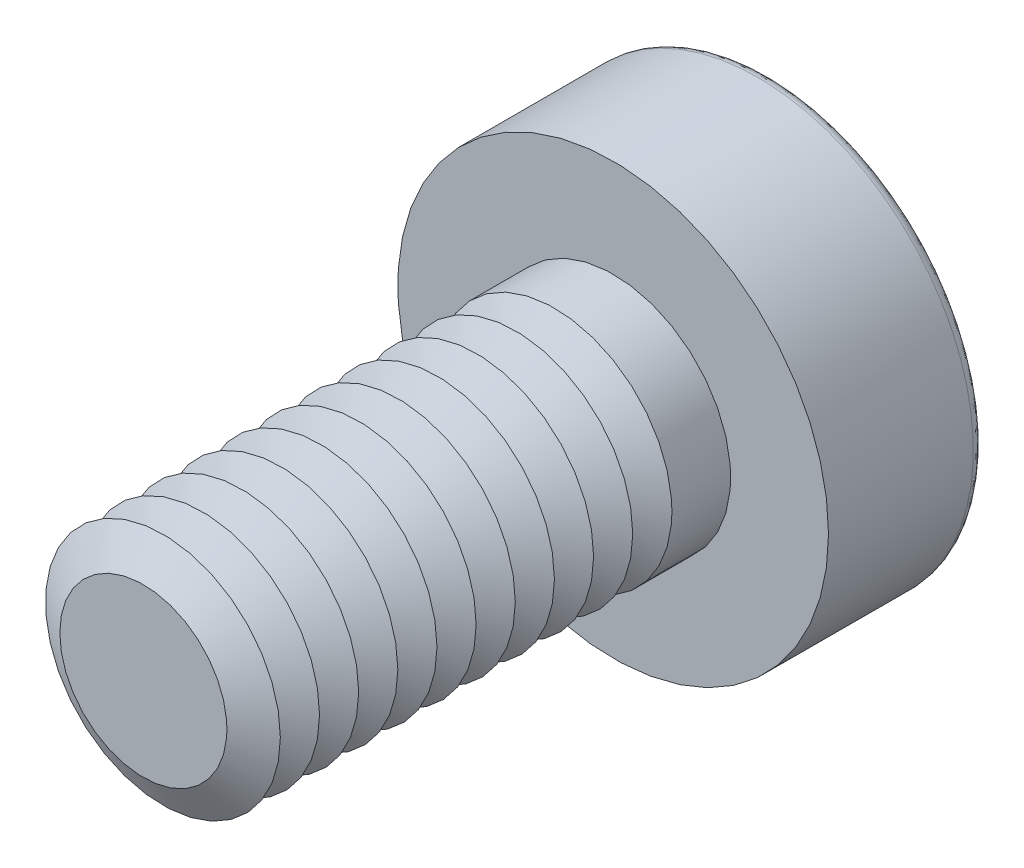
SolidWorks part; units mm, degrees
ref_plane "Front Plane" through (0, 0, 0) normal (0, 0, 1) x (1, 0, 0)
ref_plane "Top Plane" through (0, 0, 0) normal (0, 1, 0) x (1, 0, 0)
ref_plane "Right Plane" through (0, 0, 0) normal (1, 0, 0) x (0, 0, -1)
sketch "Sketch1" plane through (0, 0, 0) normal (0, 0, 1) x (1, 0, 0)
  circle A0 centre (0, 0) radius 1.5
  dimension "D1" = 3
extrude "Boss-Extrude1" add sketch "Sketch1" along normal blind 6
sketch "Sketch2" plane through (0, 0, 0) normal (0, 0, -1) x (-1, 0, 0)
  circle A0 centre (0, 0) radius 2.75
  dimension "D1" = 5.5
extrude "Boss-Extrude2" add sketch "Sketch2" along normal blind 2
sketch "Sketch3" plane through (0, 0, -2) normal (0, 0, -1) x (-1, 0, 0)
  line L1 (-0.5774, 1) -> (-1.1547, 0)
  line L2 (-1.1547, 0) -> (-0.5774, -1)
  line L3 (-0.5774, -1) -> (0.5774, -1)
  line L4 (0.5774, -1) -> (1.1547, 0)
  line L5 (1.1547, 0) -> (0.5774, 1)
  line L6 (0.5774, 1) -> (-0.5774, 1)
  circle A0 centre (0, 0) radius 1 construction
  dimension "D1" = 2
extrude "Cut-Extrude1" cut sketch "Sketch3" against normal blind 1.5
fillet "Fillet1" radius 0.15 1 edges at (-2.75, 0, -2)
sketch "Sketch4" plane through (0, 0, -0.5) normal (0, 0, -1) x (-1, 0, 0)
  line L0 (0.5774, -1) -> (1.1547, 0) construction
  circle A0 centre (0, 0) radius 1
extrude "Cut-Extrude2" cut sketch "Sketch4" against normal through all draft 60
sketch "Sketch5" plane through (0, 0, -2) normal (0, 0, -1) x (-1, 0, 0)
  circle A0 centre (0, 0) radius 1.1547
extrude "Cut-Extrude3" cut sketch "Sketch5" against normal through all draft 75
sketch "Sketch7" plane through (0, 0, 0) normal (1, 0, 0) x (0, 0, -1)
  line L25 (-6, 1.067) -> (-5.75, 1.5)
  line L26 (-6, 1.5) -> (-6, -1.5) construction
  line L27 (-5.75, 1.5) -> (-6.25, 1.5)
  line L28 (-6.25, 1.5) -> (-6, 1.067)
  line L29 (0, 1.5) -> (-6, 1.5) construction
  dimension "D1" = 0.5
revolve "Cut-Revolve1" cut sketch "Sketch7" angle 360 about axis through (0, 0, 6) along (0, 0, -1)
pattern_linear "LPattern1" count 11 spacing 0.5 along (0, 0, -1) of "Cut-Revolve1"
